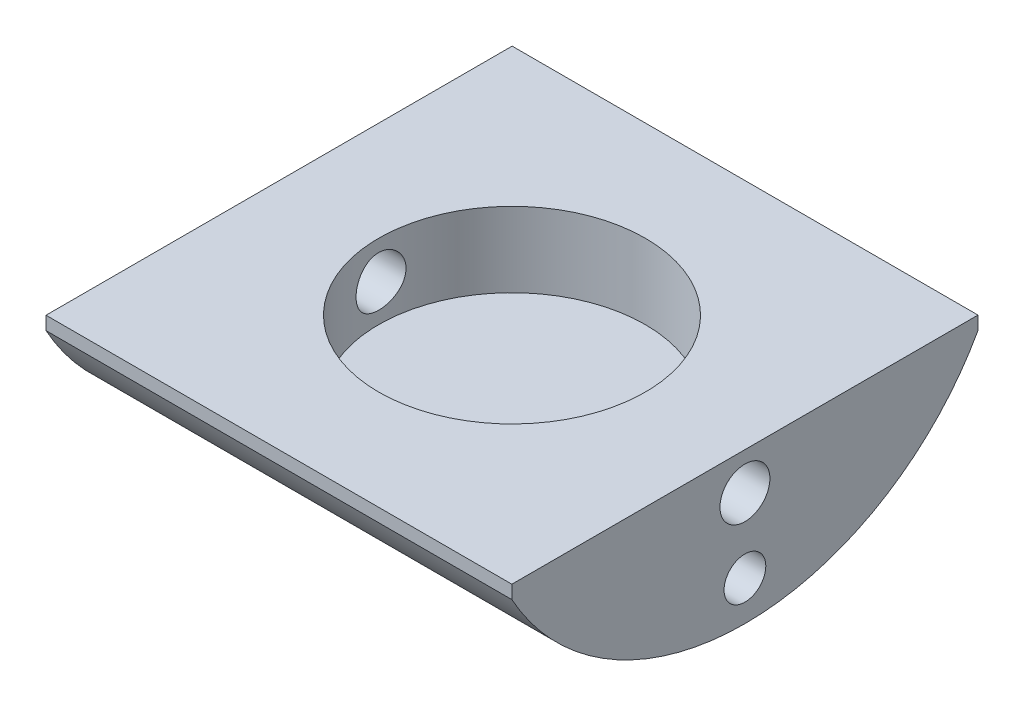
SolidWorks part; units mm, degrees
ref_plane "Front" through (0, 0, 0) normal (0, 0, 1) x (1, 0, 0)
ref_plane "Top" through (0, 0, 0) normal (0, 1, 0) x (1, 0, 0)
ref_plane "Right" through (0, 0, 0) normal (1, 0, 0) x (0, 0, -1)
sketch "Sketch1" plane through (0, 0, 0) normal (1, 0, 0) x (0, 0, -1)
  line L0 (-44.45, 0) -> (44.45, 0)
  line L1 (-44.45, 0) -> (-44.45, -2.5462)
  line L2 (44.45, -2.5462) -> (44.45, 0)
  arc A0 (-44.45, -2.5462) -> (44.45, -2.5462) centre (0, 22.0472) ccw
  dimension "D2" = 50.8
  dimension "D1" = 88.9
  dimension "D3" = 28.7528
extrude "Extrude1" add sketch "Sketch1" along normal mid plane 88.8492
sketch "Sketch2" plane through (0, 0, 0) normal (0, 1, 0) x (-1, 0, 0)
  circle A0 centre (0, 0) radius 25.4254
  dimension "D1" = 50.8508
extrude "Cut-Extrude1" cut sketch "Sketch2" against normal blind 14.2748
hole_wizard "#0-80 Tapped Hole1" positions "Sketch4" profile "Sketch3" tap size "#0-80" standard "Ansi Inch"
sketch "Sketch4" plane through (44.4246, 0, 0) normal (1, 0, 0) x (0, 0, -1)
  line L0 (44.45, 0) -> (-44.45, 0) construction
  point P0 (0, -7.1374)
  dimension "D1" = 7.1374
sketch "Sketch3" plane through (44.4246, -7.1374, 0) normal (0, 1, 0) x (0, 0, -1)
  line L0 (0, 0) -> (0, 88.8492)
  line L1 (0, 88.8492) -> (4.7625, 88.8492)
  line L2 (4.7625, 88.8492) -> (4.7625, 0)
  line L5 (4.7625, 0) -> (0, 0)
  line L11 (0, -6.35) -> (0, 107.95) construction
  dimension "Thru Tap Drill Dia." = 9.525
  dimension "Thru Tap Drill Depth" = 88.8492
hole_wizard "#7 (0.201000) Diameter Hole1" positions "Sketch6" profile "Sketch5" hole size "#7" standard "Ansi Inch"
sketch "Sketch6" plane through (44.4246, 0, 0) normal (1, 0, 0) x (0, 0, -1)
  line L0 (44.45, 0) -> (-44.45, 0) construction
  point P0 (0, -21.209)
  dimension "D1" = 21.209
sketch "Sketch5" plane through (44.4246, -21.209, 0) normal (0, 1, 0) x (0, 0, -1)
  line L0 (0, 0) -> (0, 23.0425)
  line L1 (0, 23.0425) -> (3.9814, 20.6502)
  line L2 (3.9814, 20.6502) -> (3.9814, 0)
  line L5 (3.9814, 0) -> (0, 0)
  line L10 (0, 23.0425) -> (-3.9815, 20.6502) construction
  line L11 (0, -6.35) -> (0, 107.95) construction
  dimension "Hole Dia." = 7.9629
  dimension "Hole Depth" = 20.6502
  dimension "Drill Angle" = 118
mirror "Mirror1" about plane through (0, 0, 0) normal (1, 0, 0)
